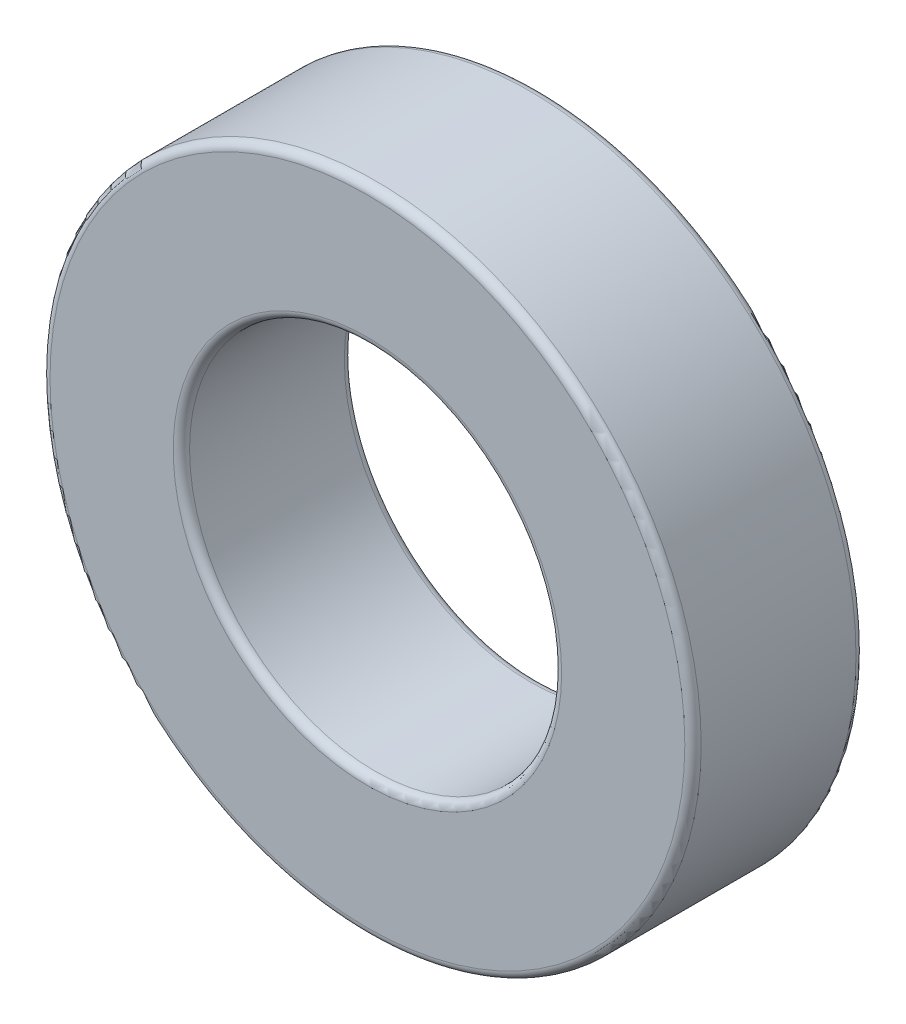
SolidWorks part; units mm, degrees
ref_plane "Plan1" through (0, 0, 0) normal (0, 0, 1) x (1, 0, 0)
ref_plane "Plan2" through (0, 0, 0) normal (0, 1, 0) x (1, 0, 0)
ref_plane "Plan3" through (0, 0, 0) normal (1, 0, 0) x (0, 0, -1)
sketch "E_corps" plane through (0, 0, 0) normal (0, 1, 0) x (1, 0, 0)
  line L0 (0, -80) -> (0, 90) construction
  line L1 (-90, 11.5) -> (60, 11.5) construction
  line L2 (-43.75, 1.1) -> (-43.75, 21.9)
  line L3 (-42.65, 23) -> (-26.1, 23)
  line L4 (-34.375, -53.6882) -> (-34.375, 66.4959) construction
  line L5 (-25, 1.1) -> (-25, 21.9)
  line L6 (-42.65, 0) -> (-26.1, 0)
  line L7 (-50, 0) -> (50, 0) construction
  arc A0 (-42.65, 23) -> (-43.75, 21.9) centre (-42.65, 21.9) ccw
  arc A1 (-26.1, 23) -> (-25, 21.9) centre (-26.1, 21.9) cw
  arc A2 (-26.1, 0) -> (-25, 1.1) centre (-26.1, 1.1) ccw
  arc A3 (-42.65, 0) -> (-43.75, 1.1) centre (-42.65, 1.1) cw
  point P5 (-34.375, 0)
  point P12 (-43.75, 11.5)
  point P15 (-34.375, 23)
  point P22 (-25, 11.5)
  dimension "Rayon" = 1.1
  dimension "Diamètre_nominal" = 50
  dimension "Diamètre_extérieur" = 87.5
  dimension "Largeur" = 23
revolve "Corps" add sketch "E_corps" angle 360 about L0
sketch "E_symbole1" plane through (0, 0, 0) normal (0, 1, 0) x (1, 0, 0)
  line L0 (0, -80) -> (0, 90) construction
  line L2 (-90, 11.5) -> (60, 11.5) construction
  line L3 (-36.3069, 11.5) -> (3.4458, 11.5) construction
  line L4 (-33.0602, 0.01) -> (-33.0508, 0.0133)
  line L5 (-33.0602, 22.99) -> (-33.0508, 22.9867)
  line L6 (-42.65, 23) -> (-26.1, 23) construction
  line L7 (0, -8.33) -> (0, 23.159) construction
  arc A0 (-33.0602, 0.01) -> (-33.0602, 22.99) centre (0, 11.5) cw
  arc A1 (-33.0508, 0.0133) -> (-33.0508, 22.9867) centre (0, 11.5) cw
  dimension "D1" = 35
  dimension "D2" = 0.01
  dimension "D3" = 0.01
revolve "Symbole1" cut sketch "E_symbole1" angle 360 about L7
sketch "E_symbole2" plane through (0, 0, 0) normal (0, 1, 0) x (1, 0, 0)
  line L0 (-31.2728, 2.99) -> (-31.2632, 2.9926)
  line L1 (-32.2718, 8.51) -> (-32.2618, 8.5109)
  line L3 (-27.7849, 11.5) -> (7.5442, 11.5) construction
  line L4 (-90, 11.5) -> (60, 11.5) construction
  line L5 (-42.65, 0) -> (-26.1, 0) construction
  line L7 (0, -10.5786) -> (0, 21.9904) construction
  line L8 (0, -80) -> (0, 90) construction
  arc A0 (-31.2728, 2.99) -> (-32.2718, 8.51) centre (0, 11.5) cw
  arc A1 (-31.2632, 2.9926) -> (-32.2618, 8.5109) centre (0, 11.5) cw
  dimension "D1" = 32.4
  dimension "D2" = 0.01
  dimension "D3" = 2.99
  dimension "D4" = 2.99
revolve "Symbole2" cut sketch "E_symbole2" angle 360 about L7
sketch "E_symbole3" plane through (0, 0, 0) normal (0, 1, 0) x (1, 0, 0)
  line L0 (-31.789, 11.5) -> (1.7695, 11.5) construction
  line L1 (-90, 11.5) -> (60, 11.5) construction
  line L2 (0, -5.6566) -> (0, 21.7395) construction
  line L3 (0, -80) -> (0, 90) construction
  line L4 (-31.2624, 20.01) -> (-31.2528, 20.0074)
  line L5 (-32.2617, 14.49) -> (-32.2518, 14.4891)
  line L6 (-42.65, 23) -> (-26.1, 23) construction
  arc A0 (-32.2617, 14.49) -> (-31.2624, 20.01) centre (0, 11.5) cw
  arc A1 (-32.2518, 14.4891) -> (-31.2528, 20.0074) centre (0, 11.5) cw
  dimension "D1" = 32.4
  dimension "D2" = 0.01
  dimension "D3" = 2.99
  dimension "D4" = 2.99
revolve "Symbole3" cut sketch "E_symbole3" angle 360 about L2
equation "\"D3@E_symbole2\" = 0.13*\"Largeur@E_corps\""
equation "\"D4@E_symbole2\" = \"D3@E_symbole2\""
equation "\"D3@E_symbole3\" = 0.13*\"Largeur@E_corps\""
equation "\"D4@E_symbole3\" = \"D3@E_symbole3\""
equation "\"D1@E_symbole2\" = 0.9*\"D1@E_symbole1\""
equation "\"D1@E_symbole3\" = \"D1@E_symbole2\""
equation "\"D1@E_symbole1\" = 0.4*\"Diamètre_extérieur@E_corps\""
